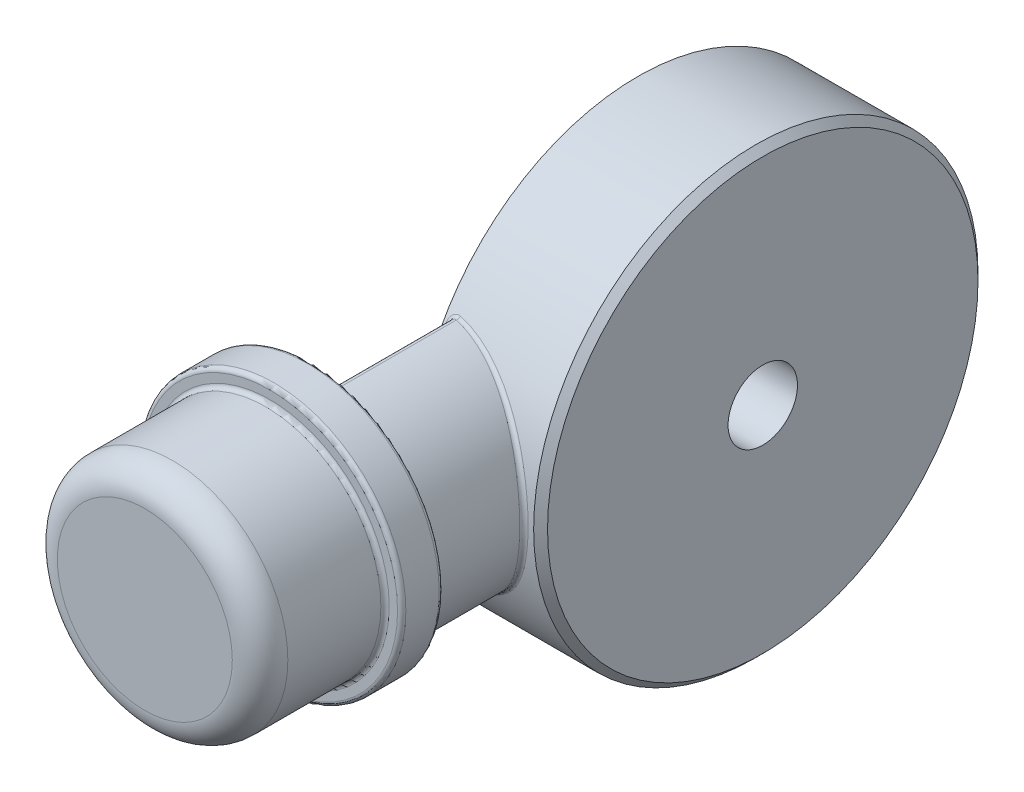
SolidWorks part; units mm, degrees
ref_plane "Plan de face" through (0, 0, 0) normal (0, 0, 1) x (1, 0, 0)
ref_plane "Plan de dessus" through (0, 0, 0) normal (0, 1, 0) x (1, 0, 0)
ref_plane "Plan de droite" through (0, 0, 0) normal (1, 0, 0) x (0, 0, -1)
imported_body "Importée3"
sketch "Esquisse1" plane through (1, 0, 0) normal (-1, 0, 0) x (0, 0, 1)
  circle A0 centre (0, 0) radius 16
extrude "Boss.-Extru.1" add sketch "Esquisse1" along normal blind 0.5
sketch "Esquisse2" plane through (0, 0, 16) normal (0, 0, 1) x (1, 0, 0)
  line L0 (1, -8.2395) -> (1, 8.2395)
  arc A0 (1, 8.2395) -> (1, -8.2395) centre (0, 0) cw
extrude "Boss.-Extru.2" add sketch "Esquisse2" along normal blind 7
ref_plane "Plan1" through (0, 0, 23) normal (0, 0, -1) x (-1, 0, 0)
sketch "Esquisse3" plane through (0, 0, 23) normal (0, 0, -1) x (-1, 0, 0)
  circle A0 centre (0, 0) radius 9.5
extrude "Boss.-Extru.3" add sketch "Esquisse3" against normal blind 3
sketch "Esquisse4" plane through (8.3, 0, 0) normal (1, 0, 0) x (0, 0, -1)
  circle A0 centre (0, 0) radius 16
extrude "Boss.-Extru.4" add sketch "Esquisse4" along normal blind 1.2
sketch "Esquisse5" plane through (0, 0, 26) normal (0, 0, 1) x (1, 0, 0)
  circle A0 centre (0, 0) radius 8.3
extrude "Boss.-Extru.5" add sketch "Esquisse5" along normal blind 9
sketch "Esquisse6" plane through (0.5, 0, 0) normal (-1, 0, 0) x (0, 0, 1)
  circle A0 centre (0, 0) radius 6.5
extrude "Boss.-Extru.6" add sketch "Esquisse6" along normal blind 5.25
sketch "Esquisse7" plane through (0.5, 0, 0) normal (-1, 0, 0) x (0, 0, 1)
  arc A0 (0.994, 14.2153) -> (-10.9161, -9.1597) centre (0, 0) ccw
  arc A1 (-10.9161, -9.1597) -> (-6.3199, -5.303) centre (-8.618, -7.2314) ccw
  arc A2 (-6.3199, -5.303) -> (0.5755, 8.2299) centre (0, 0) cw
  arc A3 (0.5755, 8.2299) -> (0.994, 14.2153) centre (0.7848, 11.2226) ccw
extrude "Enlèv. mat.-Extru.1" cut sketch "Esquisse7" against normal blind 6
hole_wizard "Diamètre du perçage Ø5.0 (5)1" positions "Esquisse9" profile "Esquisse8" hole size "Ø5.0" standard "Ansi Metric"
sketch "Esquisse9" plane through (9.5, 0, 0) normal (1, 0, 0) x (0, 0, -1)
  point P0 (0, 0)
sketch "Esquisse8" plane through (9.5, 0, 0) normal (0, 1, 0) x (0, 0, -1)
  line L0 (0, 0) -> (0, 19)
  line L1 (0, 19) -> (2.5, 19)
  line L2 (2.5, 19) -> (2.5, 0)
  line L5 (2.5, 0) -> (0, 0)
  line L11 (0, -6.35) -> (0, 107.95) construction
  dimension "Diamètre du perçage jusqu'au prochain" = 5
  dimension "Profondeur du perçage jusqu'au prochain" = 19
fillet "Congé1" radius 0.3 9 edges at (1, 0, 23) (1, 8.2395, 18.3577) (1, -8.2395, 18.3577) (8.3, 0, 23) (8.2813, 0.5567, 15.9903) (1, 0, 16) (8.3, 0, 26) (9.5, 0, 26) (9.5, 0, 23)
chamfer "Chanfrein1" distance 0.5 angle 45 1 edges at (9.5, 0, -16)
chamfer "Chanfrein2" distance 0.3 angle 45 1 edges at (-4.75, 0, 6.5)
fillet "Congé2" radius 2 1 edges at (8.3, 0, 35)
